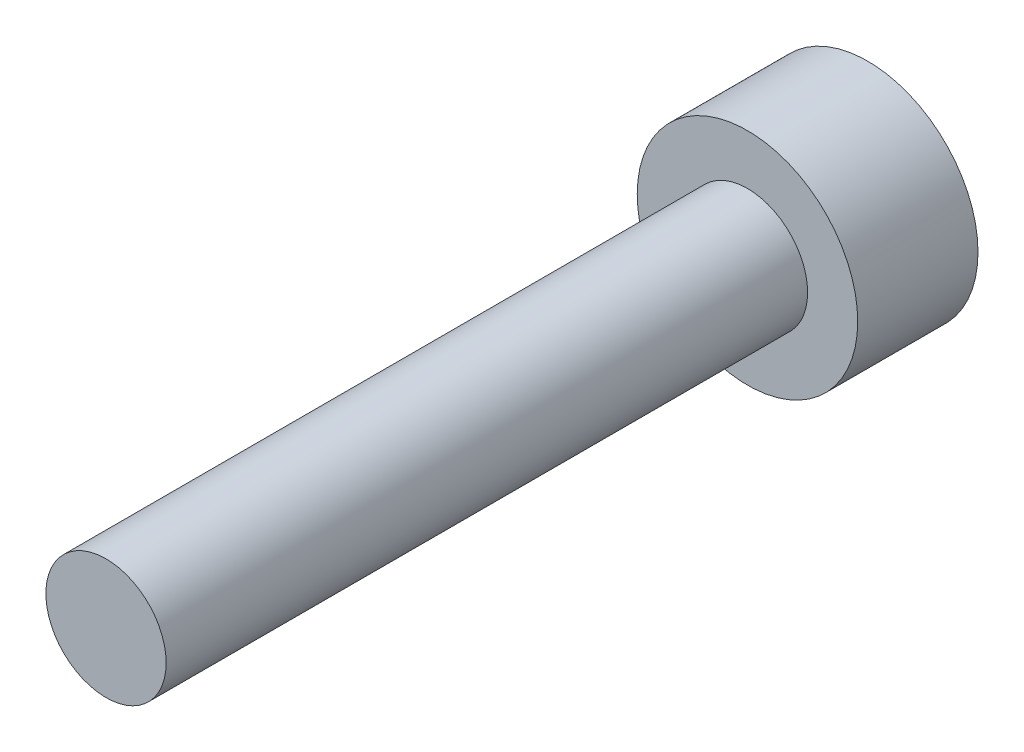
SolidWorks part; units mm, degrees
ref_plane "前视基准面" through (0, 0, 0) normal (0, 0, 1) x (1, 0, 0)
ref_plane "上视基准面" through (0, 0, 0) normal (0, 1, 0) x (1, 0, 0)
ref_plane "右视基准面" through (0, 0, 0) normal (1, 0, 0) x (0, 0, -1)
other "Configuration Table"
sketch "草图1" plane through (0, 0, 0) normal (0, 0, 1) x (1, 0, 0)
  circle A0 centre (0, 0) radius 2.75
  dimension "D1" = 5.5
extrude "Socket_head" add sketch "草图1" along normal blind 3 from offset 3
sketch "草图2" plane through (0, 0, 0) normal (0, 0, 1) x (1, 0, 0)
  circle A0 centre (0, 0) radius 1.5
  dimension "D1" = 3
extrude "Nominal_shank" add sketch "草图2" along normal blind 16
